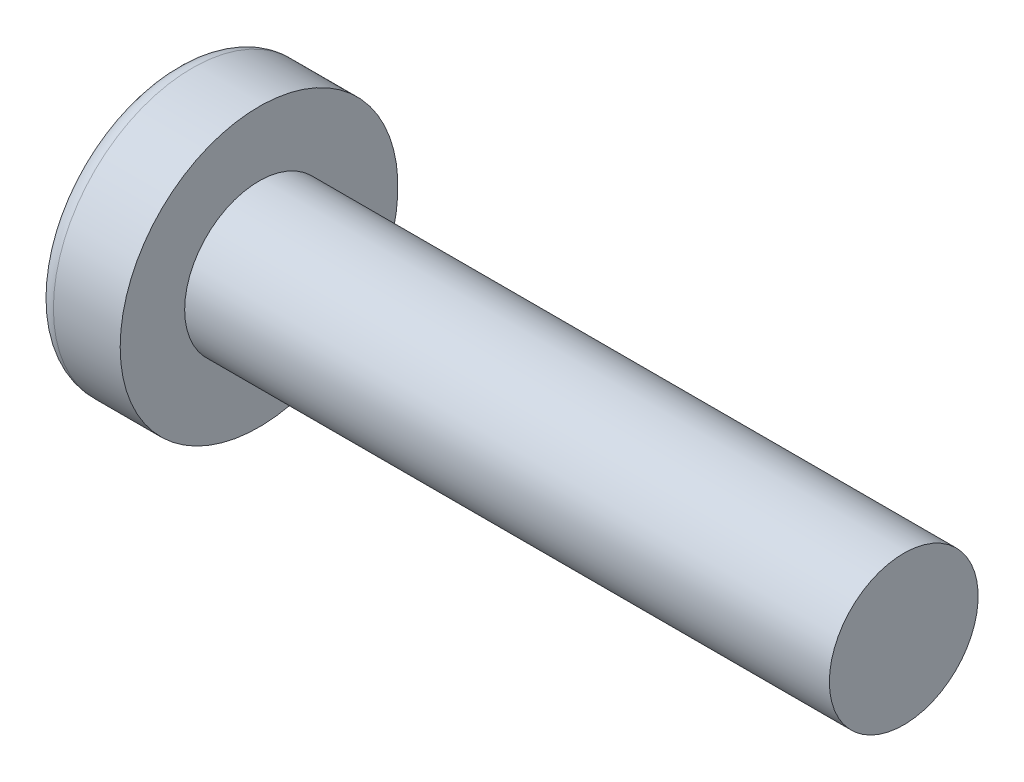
SolidWorks part; units mm, degrees
ref_plane "Plane1" through (0, 0, 0) normal (0, 0, 1) x (1, 0, 0)
ref_plane "Plane2" through (0, 0, 0) normal (0, 1, 0) x (1, 0, 0)
ref_plane "Plane3" through (0, 0, 0) normal (1, 0, 0) x (0, 0, -1)
revolve "Base-Revolve" add sketch "BodySke" angle 360 about L2
sketch "BodySke" plane through (0, 0, 0) normal (0, 0, 1) x (1, 0, 0)
  line L0 (2.4, 1.5) -> (2.4, 2.8)
  line L1 (2.9, 6.35) -> (2.9, -3.175) construction
  line L2 (-25.4, 0) -> (127, 0) construction
  line L3 (15.4, 0) -> (0, 0)
  line L4 (2.4, 1.5) -> (15.4, 1.5)
  line L5 (15.4, 1.5) -> (15.4, 0)
  line L6 (1.0534, 2.8) -> (2.4, 2.8)
  line L7 (2.4, -1.5) -> (15.4, -1.5) construction
  line L8 (2.4, 6.35) -> (2.4, -3.175) construction
  arc A0 (0.7472, 2.6293) -> (0, 0) centre (5, 0) ccw
  arc A2 (0.7472, 2.6293) -> (1.0534, 2.8) centre (1.0534, 2.44) cw
  dimension "Head_fillet_rad" = 0.36
  dimension "Head_crown_rad" = 5
  dimension "Head_ht" = 2.4
  dimension "Diameter" = 3
  dimension "Length" = 13
  dimension "Head_dia" = 5.6
  dimension "Advance" = 0.5
  dimension "Thread_nom" = 13
sketch "Sketch3" plane through (0, 0, 0) normal (1, 0, 0) x (0, 0, -1)
  line L0 (0.37, -1.45) -> (-0.37, -1.45)
  line L1 (0.37, -1.45) -> (0.37, 1.45)
  line L2 (-0.37, 1.45) -> (0.37, 1.45)
  line L3 (-0.37, 1.45) -> (-0.37, -1.45)
  dimension "D1" = 1.45
  dimension "Cross_dia" = 2.9
  dimension "D2" = 0.37
  dimension "Cross_width" = 0.74
ref_plane "Plane4" through (1.76, 0, 0) normal (1, 0, 0) x (0, 0, -1)
sketch "Sketch4" plane through (1.76, 0, 0) normal (1, 0, 0) x (0, 0, -1)
  line L0 (0.185, -0.185) -> (-0.185, -0.185)
  line L1 (0.185, -0.185) -> (0.185, 0.185)
  line L2 (-0.185, 0.185) -> (0.185, 0.185)
  line L3 (-0.185, 0.185) -> (-0.185, -0.185)
  dimension "D1" = 0.37
  dimension "D2" = 0.37
  dimension "D3" = 0.185
  dimension "D4" = 0.185
loft "Cut-Loft1" cut profiles "Sketch3", "Sketch4"
pattern_circular "CirPattern1" count 2 every 90 about axis through (0, 0, 0) along (1, 0, 0) of "Cut-Loft1"
sketch "ThdSchSke" plane through (0, 0, 0) normal (0, 0, 1) x (1, 0, 0)
  line L0 (2.9, -1.2195) -> (2.7036, -1.5)
  line L1 (2.9, -1.2195) -> (3.0964, -1.5)
  line L2 (3.0964, -1.5) -> (3.0964, -1.875)
  line L3 (-3.175, 0) -> (5.1513, 0) construction
  line L5 (3.0964, -1.875) -> (2.7036, -1.875)
  line L6 (2.7036, -1.875) -> (2.7036, -1.5)
  dimension "Thread_minor" = 2.439
  dimension "Diameter" = 3
  dimension "Start" = 2.9
  dimension "SideAngle" = 55
  dimension "VeeAngle" = 70
  dimension "Overcut" = 3.75
revolve "ThreadSchematic" cut sketch "ThdSchSke" angle 360 about L3
pattern_linear "ThdSchPat"
equation "\"D1@Sketch3\" = \"Cross_dia@Sketch3\" / 2"
equation "\"D2@Sketch3\" = \"Cross_width@Sketch3\" / 2"
equation "\"D1@Sketch4\" = \"Cross_width@Sketch3\" *.5"
equation "\"D2@Sketch4\" = \"D1@Sketch4\""
equation "\"D3@Sketch4\" = \"D1@Sketch4\" / 2"
equation "\"D4@Sketch4\" = \"D2@Sketch4\" / 2"
equation "\"Thread_length@ThreadCosmetic\" = ((sgn( (\"Length@BodySke\" - \"Advance@BodySke\" ) - \"Thread_nom@BodySke\" )-1)*( (\"Length@BodySke\" - \"Advance@BodySke\" ) - \"Thread_nom@BodySke\" ))/-2+ \"Thread_nom@BodySke\""
equation "\"Thread_minor@ThdSchSke\" = \"Thread_minor@ThreadCosmetic\""
equation "\"Diameter@ThdSchSke\" = \"Diameter@BodySke\""
equation "\"Overcut@ThdSchSke\" = \"Diameter@BodySke\" * 1.25"
equation "\"Start@ThdSchSke\" = \"Head_ht@BodySke\" + \"Length@BodySke\" - \"Thread_length@ThreadCosmetic\"  '---Non-countersunk---"
equation "\"Num_threads@ThdSchPat\" = int( \"Thread_length@ThreadCosmetic\" / \"Advance@BodySke\" + 0.999 )  + 1"
equation "\"Advance@ThdSchPat\" = \"Thread_length@ThreadCosmetic\" /  (\"Num_threads@ThdSchPat\" - 1) 'relax it"
